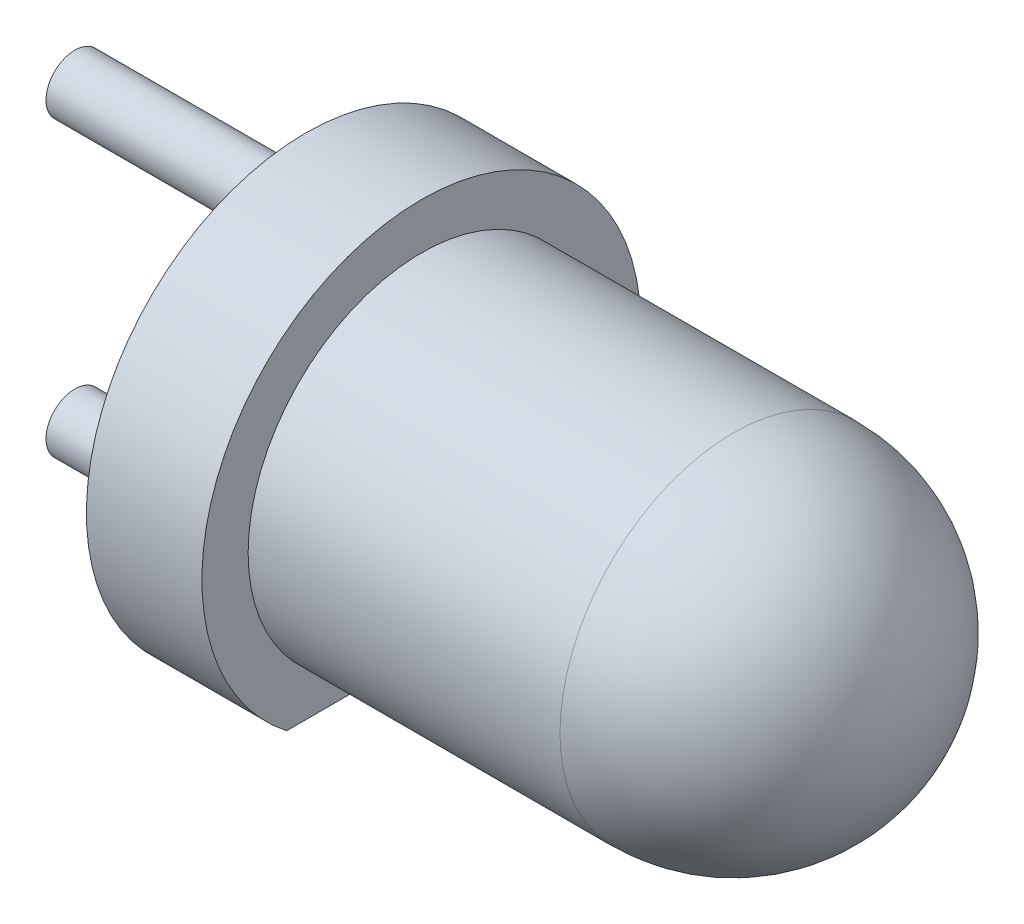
SolidWorks part; units mm, degrees
ref_plane "Plan de face" through (0, 0, 0) normal (0, 0, 1) x (1, 0, 0)
ref_plane "Plan de dessus" through (0, 0, 0) normal (0, 1, 0) x (1, 0, 0)
ref_plane "Plan de droite" through (0, 0, 0) normal (1, 0, 0) x (0, 0, -1)
sketch "Esquisse1" plane through (0, 0, 0) normal (0, 0, 1) x (1, 0, 0)
  line L1 (0, 0) -> (4.2, 0)
  line L3 (0, 1.5) -> (2.7, 1.5)
  line L5 (0, 0) -> (-1, 0)
  line L6 (0, 1.5) -> (0, 1.9)
  line L7 (0, 1.9) -> (-1, 1.9)
  line L8 (-1, 0) -> (-1, 1.9)
  arc A0 (4.2, 0) -> (2.7, 1.5) centre (2.7, 0) ccw
  dimension "D1" = 1.5
  dimension "D2" = 2.7
  dimension "D3" = 2.7
  dimension "D4" = 1
  dimension "D5" = 1.9
revolve "Révolution1" add sketch "Esquisse1" angle 360 about L1
sketch "Esquisse2" plane through (-1, 0, 0) normal (-1, 0, 0) x (0, 0, 1)
  circle A0 centre (0, 1.27) radius 0.25
  circle A1 centre (0, -1.27) radius 0.25
  dimension "D1" = 1.27
  dimension "D2" = 2.54
extrude "Extrusion1" add sketch "Esquisse2" along normal blind 2
sketch "Esquisse3" plane through (-1, 0, 0) normal (-1, 0, 0) x (0, 0, 1)
  line L1 (-1.8671, -1.5) -> (1.9356, -1.5)
  line L2 (-1.8671, -1.5) -> (-1.8671, -2.2173)
  line L3 (-1.8671, -2.2173) -> (1.9356, -2.2173)
  line L4 (1.9356, -1.5) -> (1.9356, -2.2173)
  dimension "D1" = 1.5
extrude "Enlèv. mat.-Extru.1" cut sketch "Esquisse3" against normal blind 10
